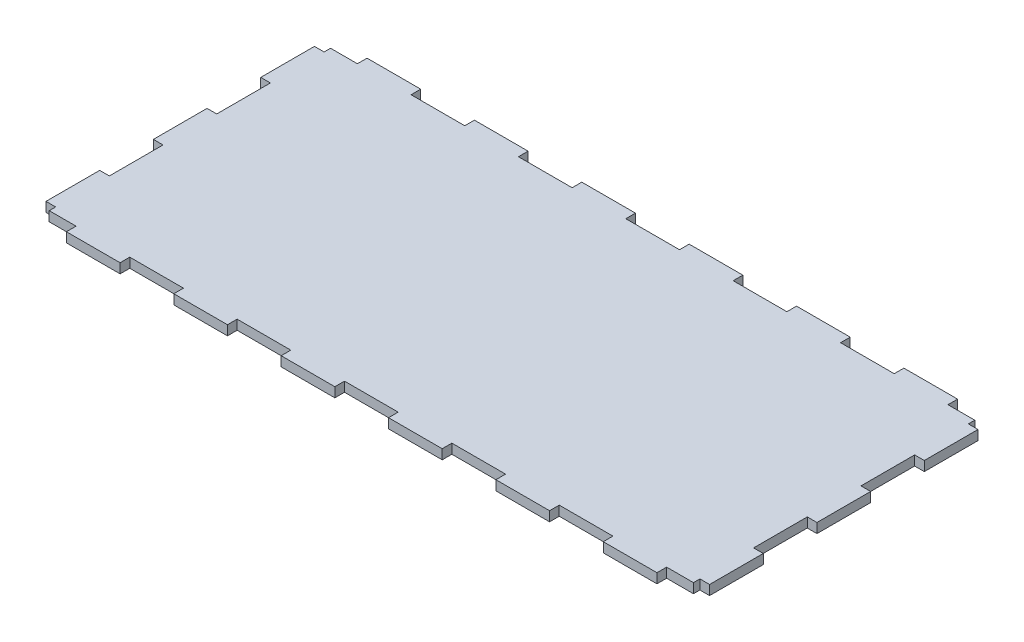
SolidWorks part; units mm, degrees
ref_plane "Front Plane" through (0, 0, 0) normal (0, 0, 1) x (1, 0, 0)
ref_plane "Top Plane" through (0, 0, 0) normal (0, 1, 0) x (1, 0, 0)
ref_plane "Right Plane" through (0, 0, 0) normal (1, 0, 0) x (0, 0, -1)
sketch "Sketch1" plane through (0, 0, 0) normal (0, 1, 0) x (1, 0, 0)
  line L0 (-275, -6) -> (-275, -15)
  line L1 (-300, 256) -> (-275, 256)
  line L2 (-300, 256) -> (-300, 250)
  line L3 (-300, -6) -> (-275, -6)
  line L4 (300, 256) -> (300, 250)
  line L5 (-275, -15) -> (-225, -15)
  line L6 (-225, -15) -> (-225, -6)
  line L7 (-175, -6) -> (-175, -15)
  line L8 (-175, -15) -> (-125, -15)
  line L9 (-125, -15) -> (-125, -6)
  line L10 (-75, -6) -> (-75, -15)
  line L11 (-75, -15) -> (-25, -15)
  line L12 (-25, -15) -> (-25, -6)
  line L13 (25, -6) -> (25, -15)
  line L14 (25, -15) -> (75, -15)
  line L15 (75, -15) -> (75, -6)
  line L16 (125, -6) -> (125, -15)
  line L17 (125, -15) -> (175, -15)
  line L18 (175, -15) -> (175, -6)
  line L19 (225, -6) -> (225, -15)
  line L20 (225, -15) -> (275, -15)
  line L21 (275, -15) -> (275, -6)
  line L22 (-275, 256) -> (-275, 265)
  line L23 (-275, 265) -> (-225, 265)
  line L24 (-225, 265) -> (-225, 256)
  line L25 (-175, 256) -> (-175, 265)
  line L26 (-175, 265) -> (-125, 265)
  line L27 (-125, 265) -> (-125, 256)
  line L28 (-75, 256) -> (-75, 265)
  line L29 (-75, 265) -> (-25, 265)
  line L30 (-25, 265) -> (-25, 256)
  line L31 (25, 256) -> (25, 265)
  line L32 (25, 265) -> (75, 265)
  line L33 (75, 265) -> (75, 256)
  line L34 (125, 256) -> (125, 265)
  line L35 (125, 265) -> (175, 265)
  line L36 (175, 265) -> (175, 256)
  line L37 (225, 256) -> (225, 265)
  line L38 (225, 265) -> (275, 265)
  line L39 (275, 265) -> (275, 256)
  line L40 (-300, 0) -> (-309, 0)
  line L41 (-309, 0) -> (-309, 50)
  line L42 (-309, 50) -> (-300, 50)
  line L43 (-309, 100) -> (-309, 150)
  line L44 (-309, 150) -> (-300, 150)
  line L45 (-300, 100) -> (-309, 100)
  line L46 (-309, 200) -> (-309, 250)
  line L47 (-309, 250) -> (-300, 250)
  line L48 (-300, 200) -> (-309, 200)
  line L49 (300, 0) -> (309, 0)
  line L50 (309, 0) -> (309, 50)
  line L51 (309, 50) -> (300, 50)
  line L52 (309, 150) -> (300, 150)
  line L53 (309, 100) -> (309, 150)
  line L54 (300, 100) -> (309, 100)
  line L55 (309, 250) -> (300, 250)
  line L56 (309, 200) -> (309, 250)
  line L57 (300, 200) -> (309, 200)
  line L58 (-300, 200) -> (-300, 150)
  line L59 (-300, 100) -> (-300, 50)
  line L60 (-300, 0) -> (-300, -6)
  line L61 (-225, -6) -> (-175, -6)
  line L62 (-125, -6) -> (-75, -6)
  line L63 (-25, -6) -> (25, -6)
  line L64 (75, -6) -> (125, -6)
  line L65 (175, -6) -> (225, -6)
  line L66 (275, -6) -> (300, -6)
  line L67 (300, 0) -> (300, -6)
  line L68 (300, 100) -> (300, 50)
  line L69 (300, 200) -> (300, 150)
  line L70 (275, 256) -> (300, 256)
  line L71 (175, 256) -> (225, 256)
  line L72 (75, 256) -> (125, 256)
  line L73 (-25, 256) -> (25, 256)
  line L74 (-125, 256) -> (-75, 256)
  line L75 (-225, 256) -> (-175, 256)
  dimension "D1" = 300
  dimension "D2" = 600
  dimension "D3" = 262
  dimension "D4" = 50
  dimension "D5" = 9
  dimension "D6" = 25
  dimension "D8" = 50
  dimension "D9" = 9
  dimension "D10" = 25
  dimension "D12" = 50
  dimension "D13" = 9
  dimension "D14" = 6
  dimension "D16" = 50
  dimension "D17" = 9
  dimension "D18" = 6
  dimension "D7" = 6
  dimension "D11" = 6
  dimension "D15" = 3
  dimension "D19" = 3
extrude "Boss-Extrude1" add sketch "Sketch1" along normal blind 9
